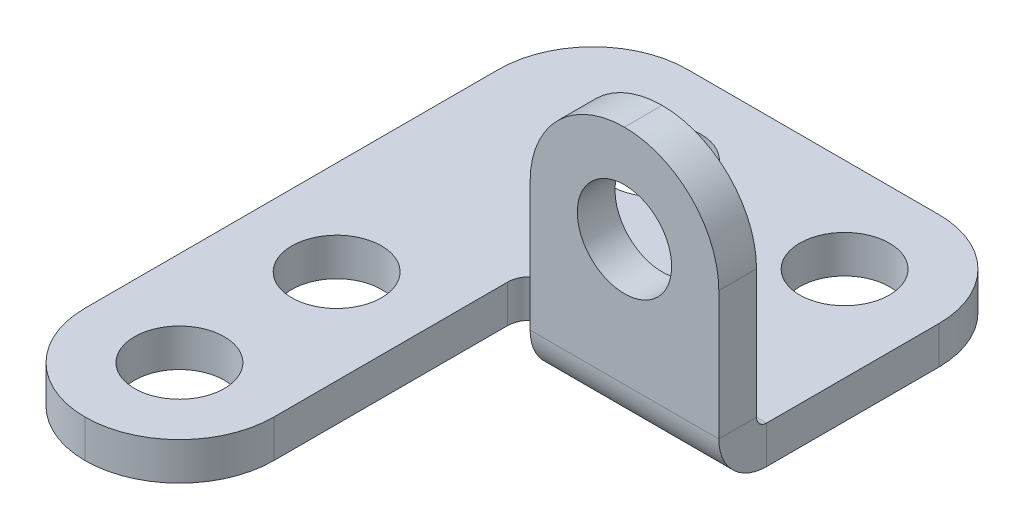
SolidWorks part; units mm, degrees
other "<Slingshot Pivot Bkt>-<Cut-Extrude3>"
ref_plane "Front Plane" through (0, 0, 0) normal (0, 0, 1) x (1, 0, 0)
ref_plane "Top Plane" through (0, 0, 0) normal (0, 1, 0) x (1, 0, 0)
ref_plane "Right Plane" through (0, 0, 0) normal (1, 0, 0) x (0, 0, -1)
mirrored part "Slingshot Pivot Bkt_Mirrored"
